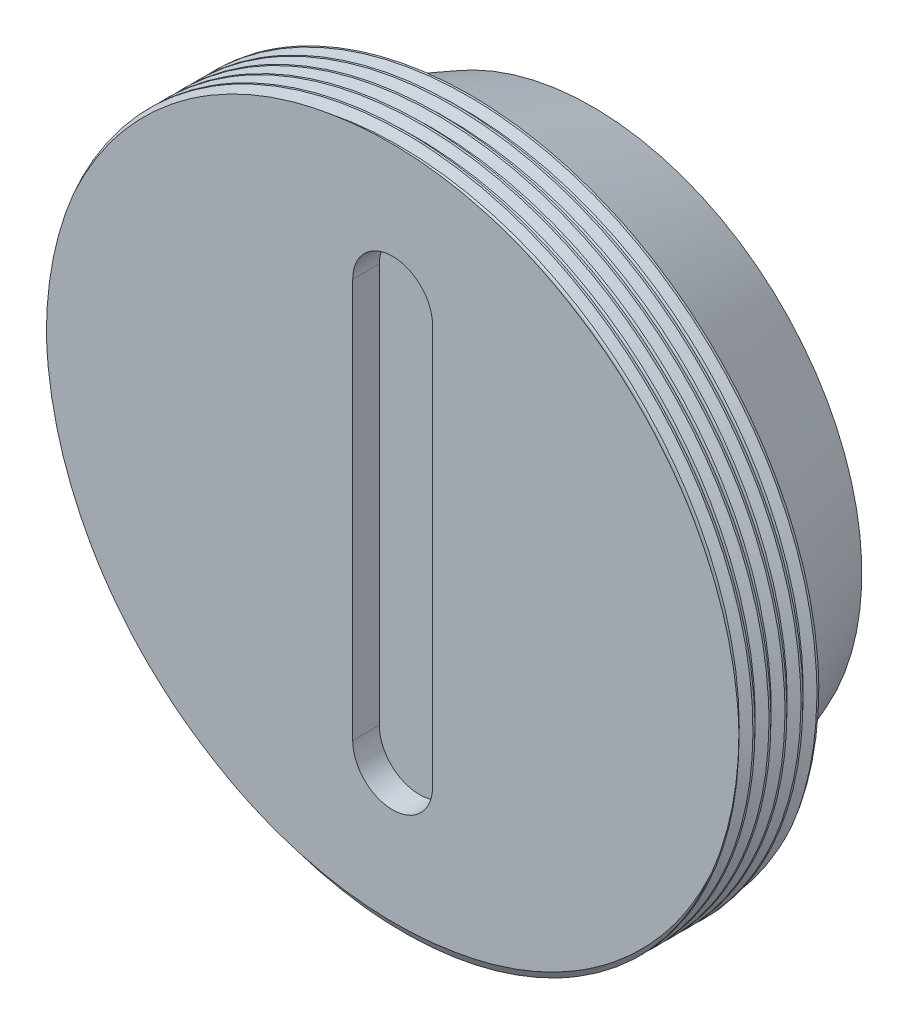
SolidWorks part; units mm, degrees
other "IcePack_Lid"
ref_plane "Front Plane" through (0, 0, 0) normal (0, 0, 1) x (1, 0, 0)
ref_plane "Top Plane" through (0, 0, 0) normal (0, 1, 0) x (1, 0, 0)
ref_plane "Right Plane" through (0, 0, 0) normal (1, 0, 0) x (0, 0, -1)
imported_body "Imported3"
sketch "Sketch1" plane through (0, 0, -2.5) normal (0, 0, -1) x (-1, 0, 0)
  line L0 (-10, -37.5) -> (-10, 37.5)
  line L1 (10, 37.5) -> (10, -37.5)
  arc A0 (10, -37.5) -> (-10, -37.5) centre (0, -37.5) cw
  arc A1 (-10, 37.5) -> (10, 37.5) centre (0, 37.5) cw
extrude "Boss-Extrude1" add sketch "Sketch1" along normal blind 5
sketch "Sketch2" plane through (0, 0, 0) normal (0, 0, 1) x (1, 0, 0)
  line L0 (-7.5, 37.5) -> (-7.5, -37.5)
  line L1 (7.5, -37.5) -> (7.5, 37.5)
  arc A0 (7.5, 37.5) -> (-7.5, 37.5) centre (0, 37.5) ccw
  arc A1 (-7.5, -37.5) -> (7.5, -37.5) centre (0, -37.5) ccw
extrude "Cut-Extrude1" cut sketch "Sketch2" against normal blind 5
ref_plane "Plane1" through (0, 0, 0) normal (0, -1, 0) x (1, 0, 0)
sketch "Sketch3" plane through (0, 0, 0) normal (0, -1, 0) x (1, 0, 0)
  line L0 (58.973, -15) -> (0, -15)
  line L1 (0, -15) -> (0, -37.5)
  line L2 (0, -37.5) -> (50.573, -37.5)
  line L3 (50.573, -37.5) -> (58.973, -15)
  line L4 (0, -15) -> (0, -37.5) construction
revolve "Revolve1" add sketch "Sketch3" angle 360 about L4
sketch "Sketch4" plane through (0, 0, 0) normal (0, -1, 0) x (1, 0, 0)
  line L0 (57.2378, -12.5) -> (0, -12.5)
  line L1 (0, -12.5) -> (0, -37.5)
  line L2 (0, -37.5) -> (25, -37.5)
  line L3 (25, -37.5) -> (25, -35)
  line L4 (25, -35) -> (48.8378, -35)
  line L5 (48.8378, -35) -> (57.2378, -12.5)
  line L6 (0, -12.5) -> (0, -37.5) construction
revolve "Cut-Revolve1" cut sketch "Sketch4" angle 360 about L6
